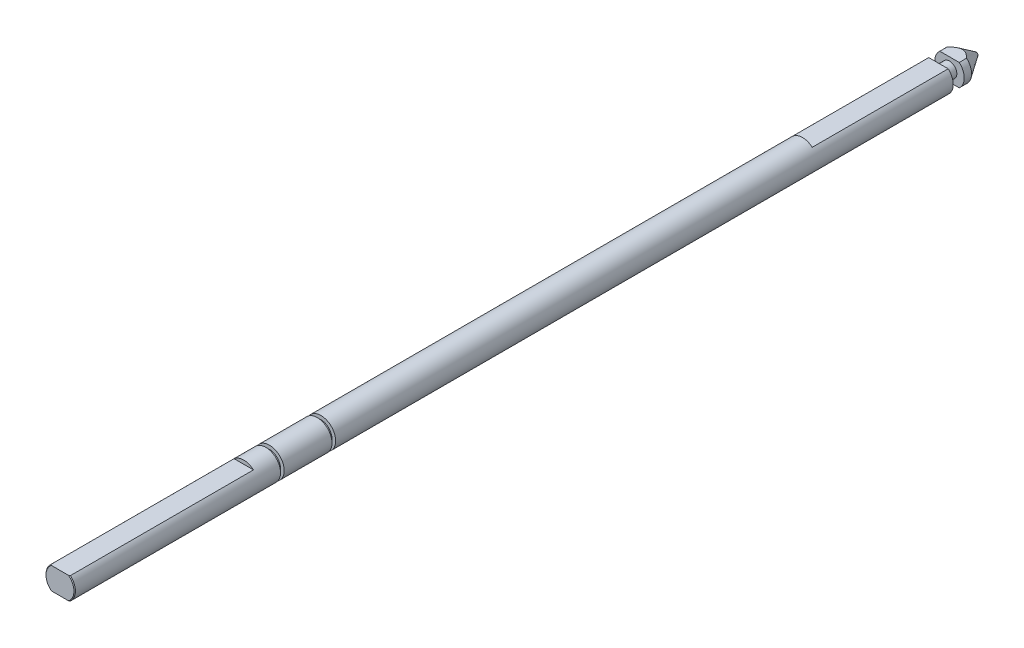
SolidWorks part; units mm, degrees
ref_plane "Plan1" through (0, 0, 0) normal (0, 0, 1) x (1, 0, 0)
ref_plane "Plan2" through (0, 0, 0) normal (0, 1, 0) x (1, 0, 0)
ref_plane "Plan3" through (0, 0, 0) normal (1, 0, 0) x (0, 0, -1)
sketch "Esquisse1" plane through (0, 0, 0) normal (0, 0, 1) x (1, 0, 0)
  circle A0 centre (0, 0) radius 2
  dimension "D1" = 4
extrude "Base-Extrusion" add sketch "Esquisse1" along normal blind 125
chamfer "Chanfrein1" distance 0.1 angle 45 1 edges at (2, 0, 125)
sketch "Esquisse2" plane through (0, 0, 0) normal (1, 0, 0) x (0, 0, -1)
  line L0 (-125, 1.9) -> (-125, -1.9) construction
  line L1 (-100, 11.5) -> (-125, 11.5)
  line L2 (-100, 11.5) -> (-100, 1.5)
  line L3 (-100, 1.5) -> (-125, 1.5)
  line L4 (-125, 11.5) -> (-125, 1.5)
  line L5 (-125, -1.5) -> (-100, -1.5)
  line L6 (-125, -1.5) -> (-125, -11.5)
  line L7 (-125, -11.5) -> (-100, -11.5)
  line L8 (-100, -1.5) -> (-100, -11.5)
  dimension "D1" = 25
  dimension "D3" = 1.5
  dimension "D4" = 3
extrude "Enlèv. mat.-Extru.1" cut sketch "Esquisse2" against normal mid plane 10
sketch "Esquisse4" plane through (0, 0, 0) normal (1, 0, 0) x (0, 0, -1)
  line L0 (0, 0) -> (-3, 2)
  line L1 (0, -2) -> (0, 2) construction
  line L2 (0, 2) -> (-100, 2) construction
  line L3 (-3, 2) -> (-3, 5.0217)
  line L4 (-3, 5.0217) -> (1.5172, 5.0217)
  line L5 (1.5172, 5.0217) -> (1.63, 0)
  line L6 (-124.9, 0) -> (-125, 0) construction
  line L7 (1.63, 0) -> (0, 0)
  line L8 (0, 0) -> (-5.4417, 0) construction
  dimension "D1" = 3
revolve "Enlèvement de matière-Révolution1" cut sketch "Esquisse4" angle 360 about L8
sketch "Esquisse5" plane through (0, 0, 0) normal (0, 0, 1) x (1, 0, 0)
  circle A0 centre (0, 0) radius 0.25
  dimension "D1" = 0.5
extrude "Enlèv. mat.-Extru.3" cut sketch "Esquisse5" along normal blind 0.5
sketch "Esquisse6" plane through (0, 0, 0) normal (1, 0, 0) x (0, 0, -1)
  line L1 (-89.5, 1.5) -> (-90, 1.5)
  line L2 (-89.5, 1.5) -> (-89.5, 3.3626)
  line L3 (-89.5, 3.3626) -> (-90, 3.3626)
  line L4 (-90, 1.5) -> (-90, 3.3626)
  line L5 (-96.5, 3.3626) -> (-97, 3.3626)
  line L6 (-96.5, 3.3626) -> (-96.5, 1.5)
  line L7 (-96.5, 1.5) -> (-97, 1.5)
  line L8 (-97, 3.3626) -> (-97, 1.5)
  line L9 (-124.9, 0) -> (-3, 0) construction
  line L10 (-129.9, 0) -> (-87.8835, 0) construction
  line L11 (-124.9, 0) -> (-125, 0) construction
  line L12 (-125, 1.5) -> (-125, -1.5) construction
  dimension "D1" = 6.5
  dimension "D2" = 28
  dimension "D3" = 0.5
  dimension "D4" = 0.5
  dimension "D5" = 1.5
revolve "Enlèvement de matière-Révolution2" cut sketch "Esquisse6" angle 360 about L10
sketch "Esquisse7" plane through (0, 0, 0) normal (1, 0, 0) x (0, 0, -1)
  line L0 (-3, 2) -> (-3, -2) construction
  line L1 (-4, 11) -> (-5.5, 11)
  line L2 (-4, 11) -> (-4, 1)
  line L3 (-4, 1) -> (-5.5, 1)
  line L4 (-5.5, 11) -> (-5.5, 1)
  line L5 (-89.5, 0) -> (-3, 0) construction
  line L6 (-1.5838, 0) -> (-16.7647, 0) construction
  line L7 (-89.5, 0) -> (-3, 0) construction
  dimension "D1" = 1
  dimension "D2" = 1.5
  dimension "D3" = 1
revolve "Enlèvement de matière-Révolution3" cut sketch "Esquisse7" angle 360 about L6
sketch "Esquisse8" plane through (0, 0, 0) normal (1, 0, 0) x (0, 0, -1)
  line L0 (0, 0) -> (-5.4417, 0) construction
  line L1 (0, 11.5) -> (-24, 11.5)
  line L2 (0, 11.5) -> (0, 1.5)
  line L3 (0, 1.5) -> (-24, 1.5)
  line L4 (-24, 11.5) -> (-24, 1.5)
  line L5 (0, -1.5) -> (-24, -1.5)
  line L6 (0, -1.5) -> (0, -11.5)
  line L7 (0, -11.5) -> (-24, -11.5)
  line L8 (-24, -1.5) -> (-24, -11.5)
  dimension "D1" = 1.5
  dimension "D2" = 3
  dimension "D3" = 24
  dimension "D4" = 24
extrude "Enlèv. mat.-Extru.4" cut sketch "Esquisse8" against normal mid plane 10
